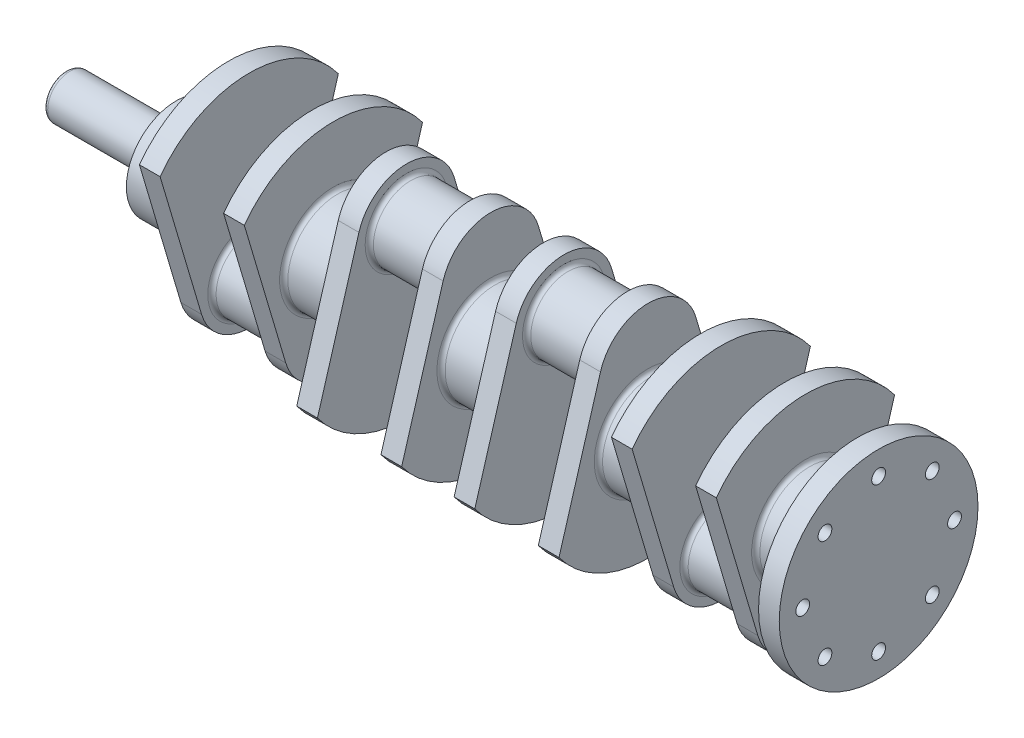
SolidWorks part; units mm, degrees
ref_plane "Front Plane" through (0, 0, 0) normal (0, 0, 1) x (1, 0, 0)
ref_plane "Top Plane" through (0, 0, 0) normal (0, 1, 0) x (1, 0, 0)
ref_plane "Right Plane" through (0, 0, 0) normal (1, 0, 0) x (0, 0, -1)
sketch "Sketch3" plane through (0, 0, 0) normal (1, 0, 0) x (0, 0, -1)
  circle A0 centre (0, 0) radius 36
  dimension "D1" = 72
extrude "Boss-Extrude2" add sketch "Sketch3" along normal blind 19
sketch "Sketch4" plane through (19, 0, 0) normal (1, 0, 0) x (0, 0, -1)
  line L0 (0, 144.21) -> (0, -92.3337) construction
  line L1 (-34.5175, -54.2246) -> (-64.5699, 47.2306)
  line L2 (34.5175, -54.2246) -> (64.5699, 47.2306)
  arc A1 (-34.5175, -54.2246) -> (34.5175, -54.2246) centre (0, -44) ccw
  arc A2 (-64.5699, 47.2306) -> (64.5699, 47.2306) centre (0, 0) cw
  point P5 (0, 0)
  point P11 (0, 0)
  point P12 (0, 80)
  point P13 (0, 0)
  point P14 (0, 0)
  point P15 (0, 0)
  point P16 (0, 144.21)
  point P17 (0, 0)
  dimension "D3" = 72
  dimension "D4" = 80
  dimension "D2" = 44
  dimension "D5" = 33
extrude "Boss-Extrude3" add sketch "Sketch4" along normal blind 15 contours A2 L2 A1 L1
sketch "Sketch5" plane through (34, 0, 0) normal (1, 0, 0) x (0, 0, -1)
  arc A0 (-34.5175, -54.2246) -> (34.5175, -54.2246) centre (0, -44) ccw construction
  arc A1 (-34.5175, -54.2246) -> (34.5175, -54.2246) centre (0, -44) ccw
  circle A2 centre (0, -44) radius 27
  dimension "D1" = 54
extrude "Boss-Extrude4" add sketch "Sketch5" along normal blind 23 contours A2
mirror "Mirror3" about plane through (57, 0, 0) normal (1, 0, 0)
mirror "Mirror4" about plane through (114, 0, 0) normal (-1, 0, 0)
move or copy body "Body-Move/Copy1" bodies to move or copy 108 copy no rotation origin (0, 0, 0) rotation axis (1, 0, 0) rotation angle 180
mirror "Mirror6" about plane through (228, 0, 0) normal (-1, 0, 0)
sketch "Sketch8" plane through (0, 0, 0) normal (-1, 0, 0) x (0, 0, 1)
  circle A1 centre (0, 0) radius 36
  circle A2 centre (0, 0) radius 36
  dimension "D1" = 0
extrude "Boss-Extrude5" add sketch "Sketch8" along normal blind 19
sketch "Sketch9" plane through (456, 0, 0) normal (1, 0, 0) x (0, 0, -1)
  circle A1 centre (0, 0) radius 36
  circle A2 centre (0, 0) radius 36
  dimension "D1" = 0
extrude "Boss-Extrude6" add sketch "Sketch9" along normal blind 19
combine bodies "Combine1" operation type add bodies to combine 112 109 111 113
sketch "Sketch10" plane through (-19, 0, 0) normal (-1, 0, 0) x (0, 0, 1)
  circle A0 centre (0, 0) radius 16
  dimension "D1" = 32
extrude "Boss-Extrude7" add sketch "Sketch10" along normal blind 80
sketch "Sketch11" plane through (475, 0, 0) normal (1, 0, 0) x (0, 0, -1)
  circle A0 centre (0, 0) radius 72
  dimension "D1" = 144
extrude "Boss-Extrude8" add sketch "Sketch11" along normal blind 15
sketch "Sketch12" plane through (490, 0, 0) normal (1, 0, 0) x (0, 0, -1)
  line L0 (0, 59.6211) -> (0, -60.6287) construction
  circle A0 centre (0, 55) radius 5
  circle A1 centre (38.8909, 38.8909) radius 5
  circle A2 centre (55, 0) radius 5
  circle A3 centre (38.8909, -38.8909) radius 5
  circle A4 centre (0, -55) radius 5
  circle A5 centre (-38.8909, -38.8909) radius 5
  circle A6 centre (-55, 0) radius 5
  circle A7 centre (-38.8909, 38.8909) radius 5
  circle A8 centre (0, 0) radius 72 construction
  point P21 (0, 0)
  dimension "D2" = 10
  dimension "D1" = 55
  dimension "D4" = 38.8909
  dimension "D3" = 8
extrude "Cut-Extrude1" cut sketch "Sketch12" against normal up to next
fillet "Fillet1" radius 3 19 edges at (475, 0, -36) (361, 0, -36) (376, -44, 27) (437, 0, -36) (422, -44, 27) (323, 0, 36) (308, 44, -27) (247, 0, 36) (262, 44, -27) (133, 0, 36) (148, 44, -27) (209, 0, 36) (194, 44, -27) (95, 0, -36) (80, -44, 27) (19, 0, -36) (34, -44, 27) (-19, 0, 16) (-99, 0, 16)
